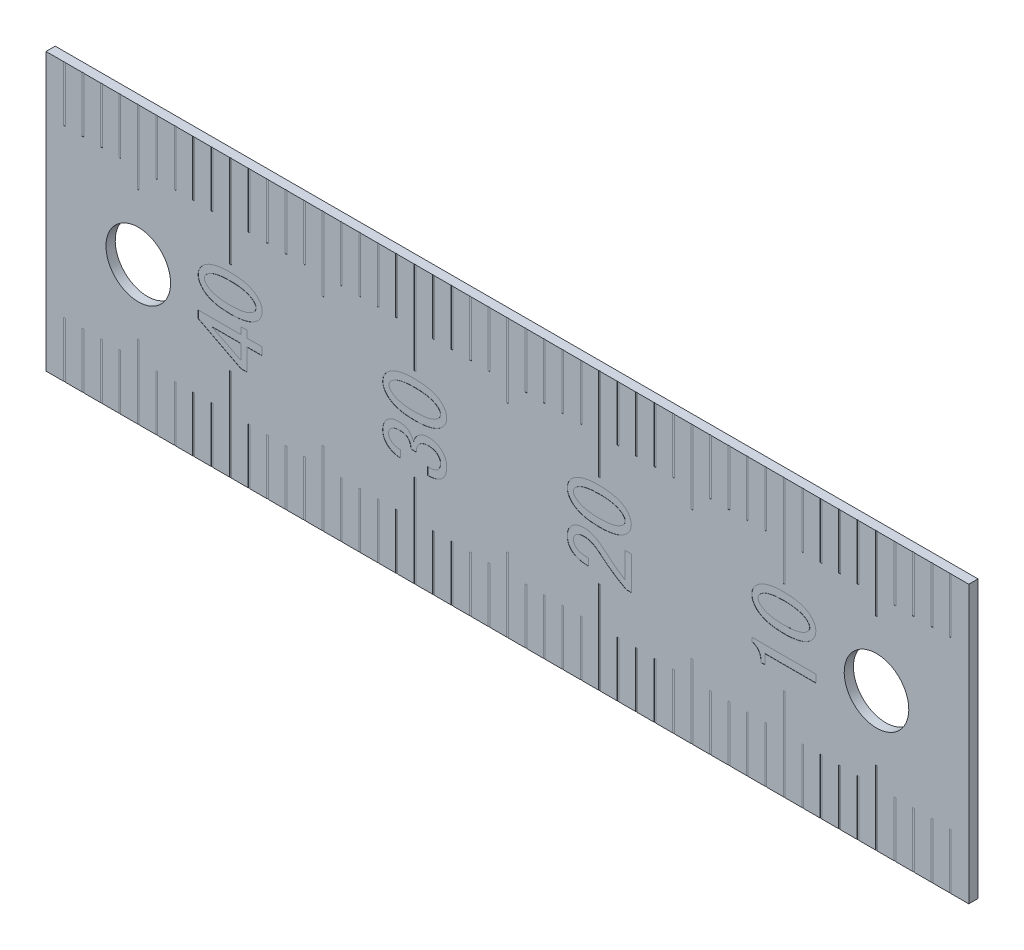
SolidWorks part; units mm, degrees
ref_plane "Front" through (0, 0, 0) normal (0, 0, 1) x (1, 0, 0)
ref_plane "Top" through (0, 0, 0) normal (0, 1, 0) x (1, 0, 0)
ref_plane "Right" through (0, 0, 0) normal (1, 0, 0) x (0, 0, -1)
sketch "Sketch1" plane through (0, 0, 0) normal (0, 0, 1) x (1, 0, 0)
  line L1 (0, 0) -> (0, 50)
  line L2 (0, 0) -> (15, 0)
  line L3 (15, 0) -> (15, 50)
  line L4 (0, 50) -> (15, 50)
  dimension "D1" = 50
  dimension "D2" = 15
extrude "Extrude1" add sketch "Sketch1" along normal blind 0.5
sketch "Sketch2" plane through (0, 0, 0.5) normal (0, 0, 1) x (1, 0, 0)
  line L0 (0, 50) -> (0, 0) construction
  line L1 (0, 0) -> (15, 0) construction
  line L2 (15, 50) -> (0, 50) construction
  circle A0 centre (7.5, 5) radius 1.75
  circle A1 centre (7.5, 45) radius 1.75
  dimension "D1" = 7.5
  dimension "D2" = 7.5
  dimension "D3" = 5
  dimension "D4" = 5
  dimension "D5" = 3.5
  dimension "D6" = 3.5
extrude "Extrude2" cut sketch "Sketch2" against normal through all
sketch "Sketch3" plane through (0, 0, 0.5) normal (0, 0, 1) x (1, 0, 0)
  line L0 (15, 50) -> (0, 50) construction
  line L1 (5.25, 28.25) -> (9.75, 28.25) construction
  line L2 (5.25, 18.25) -> (9.75, 18.25) construction
  line L3 (5.25, 8.25) -> (9.75, 8.25) construction
  line L5 (0, 50) -> (0, 0) construction
  line L7 (5.25, 38.25) -> (9.75, 38.25) construction
  line L8 (5.25, 38.25) -> (5.25, 41.75) construction
  line L9 (7.5, 0) -> (7.5, 50) construction
  line L10 (0, 0) -> (15, 0) construction
  line L11 (0, 40) -> (15, 40) construction
  line L12 (15, 0) -> (15, 50) construction
  line L13 (5.25, 41.75) -> (9.75, 41.75) construction
  line L14 (9.75, 38.25) -> (9.75, 41.75) construction
  line L15 (5.25, 38.25) -> (9.75, 41.75) construction
  line L16 (5.25, 41.75) -> (9.75, 38.25) construction
  circle A0 centre (7.5, 45) radius 1.75 construction
  text T0 "40" font "ＭＳ ゴシック" height 3.5
  text T1 "30" font "ＭＳ ゴシック" height 3.5
  text T2 "20" font "ＭＳ ゴシック" height 3.5
  text T3 "10" font "ＭＳ ゴシック" height 3.5
  point P7 (7.5, 40)
  dimension "D2" = 7.5
  dimension "D1" = 4
  dimension "D6" = 10
  dimension "D5" = 4.5
  dimension "D7" = 3.5
extrude "Extrude3" cut sketch "Sketch3" against normal blind 0.01
sketch "Sketch4" plane through (0, 0, 0.5) normal (0, 0, 1) x (1, 0, 0)
  line L0 (15, 40.05) -> (10, 40.05)
  line L1 (15, 0) -> (15, 50) construction
  line L2 (10, 40.05) -> (10, 39.95)
  line L3 (10, 39.95) -> (15, 39.95)
  line L4 (15, 39.95) -> (15, 40.05)
  line L5 (15, 50) -> (0, 50) construction
  line L6 (15, 48.05) -> (15, 47.95)
  line L7 (15, 44.95) -> (11, 44.95)
  line L8 (15, 44.95) -> (15, 45.05)
  line L9 (15, 45.05) -> (11, 45.05)
  line L10 (11, 44.95) -> (11, 45.05)
  line L11 (15, 49.05) -> (12, 49.05)
  line L12 (15, 49.05) -> (15, 48.95)
  line L13 (15, 48.95) -> (12, 48.95)
  line L14 (12, 49.05) -> (12, 48.95)
  line L15 (15, 48.05) -> (12, 48.05)
  line L16 (15, 47.95) -> (12, 47.95)
  line L17 (12, 48.05) -> (12, 47.95)
  line L18 (15, 47.05) -> (15, 46.95)
  line L19 (15, 47.05) -> (12, 47.05)
  line L20 (15, 46.95) -> (12, 46.95)
  line L21 (12, 47.05) -> (12, 46.95)
  line L22 (15, 46.05) -> (15, 45.95)
  line L23 (15, 46.05) -> (12, 46.05)
  line L24 (15, 45.95) -> (12, 45.95)
  line L25 (12, 46.05) -> (12, 45.95)
  line L26 (15, 30.05) -> (10, 30.05)
  line L27 (10, 30.05) -> (10, 29.95)
  line L28 (10, 29.95) -> (15, 29.95)
  line L29 (15, 29.95) -> (15, 30.05)
  line L30 (15, 44.05) -> (15, 43.95)
  line L31 (15, 44.05) -> (12, 44.05)
  line L32 (15, 43.95) -> (12, 43.95)
  line L33 (12, 44.05) -> (12, 43.95)
  line L34 (15, 43.05) -> (15, 42.95)
  line L35 (15, 43.05) -> (12, 43.05)
  line L36 (15, 42.95) -> (12, 42.95)
  line L37 (12, 43.05) -> (12, 42.95)
  line L38 (15, 42.05) -> (15, 41.95)
  line L39 (15, 42.05) -> (12, 42.05)
  line L40 (15, 41.95) -> (12, 41.95)
  line L41 (12, 42.05) -> (12, 41.95)
  line L42 (15, 41.05) -> (15, 40.95)
  line L43 (15, 41.05) -> (12, 41.05)
  line L44 (15, 40.95) -> (12, 40.95)
  line L45 (12, 41.05) -> (12, 40.95)
  line L46 (12, 45.05) -> (12, 44.95)
  line L47 (15, 45.05) -> (12, 45.05)
  line L48 (15, 44.95) -> (12, 44.95)
  line L49 (15, 45.05) -> (15, 44.95)
  line L50 (15, 38.05) -> (15, 37.95)
  line L51 (15, 34.95) -> (11, 34.95)
  line L52 (15, 34.95) -> (15, 35.05)
  line L53 (15, 35.05) -> (11, 35.05)
  line L54 (11, 34.95) -> (11, 35.05)
  line L55 (15, 39.05) -> (12, 39.05)
  line L56 (15, 39.05) -> (15, 38.95)
  line L57 (15, 38.95) -> (12, 38.95)
  line L58 (12, 39.05) -> (12, 38.95)
  line L59 (15, 38.05) -> (12, 38.05)
  line L60 (15, 37.95) -> (12, 37.95)
  line L61 (12, 38.05) -> (12, 37.95)
  line L62 (15, 37.05) -> (15, 36.95)
  line L63 (15, 37.05) -> (12, 37.05)
  line L64 (15, 36.95) -> (12, 36.95)
  line L65 (12, 37.05) -> (12, 36.95)
  line L66 (15, 36.05) -> (15, 35.95)
  line L67 (15, 36.05) -> (12, 36.05)
  line L68 (15, 35.95) -> (12, 35.95)
  line L69 (12, 36.05) -> (12, 35.95)
  line L70 (15, 34.05) -> (15, 33.95)
  line L71 (15, 34.05) -> (12, 34.05)
  line L72 (15, 33.95) -> (12, 33.95)
  line L73 (12, 34.05) -> (12, 33.95)
  line L74 (15, 33.05) -> (15, 32.95)
  line L75 (15, 33.05) -> (12, 33.05)
  line L76 (15, 32.95) -> (12, 32.95)
  line L77 (12, 33.05) -> (12, 32.95)
  line L78 (15, 32.05) -> (15, 31.95)
  line L79 (15, 32.05) -> (12, 32.05)
  line L80 (15, 31.95) -> (12, 31.95)
  line L81 (12, 32.05) -> (12, 31.95)
  line L82 (15, 31.05) -> (15, 30.95)
  line L83 (15, 31.05) -> (12, 31.05)
  line L84 (15, 30.95) -> (12, 30.95)
  line L85 (12, 31.05) -> (12, 30.95)
  line L86 (15, 20.05) -> (10, 20.05)
  line L87 (10, 20.05) -> (10, 19.95)
  line L88 (10, 19.95) -> (15, 19.95)
  line L89 (15, 19.95) -> (15, 20.05)
  line L90 (15, 28.05) -> (15, 27.95)
  line L91 (15, 24.95) -> (11, 24.95)
  line L92 (15, 24.95) -> (15, 25.05)
  line L93 (15, 25.05) -> (11, 25.05)
  line L94 (11, 24.95) -> (11, 25.05)
  line L95 (15, 29.05) -> (12, 29.05)
  line L96 (15, 29.05) -> (15, 28.95)
  line L97 (15, 28.95) -> (12, 28.95)
  line L98 (12, 29.05) -> (12, 28.95)
  line L99 (15, 28.05) -> (12, 28.05)
  line L100 (15, 27.95) -> (12, 27.95)
  line L101 (12, 28.05) -> (12, 27.95)
  line L102 (15, 27.05) -> (15, 26.95)
  line L103 (15, 27.05) -> (12, 27.05)
  line L104 (15, 26.95) -> (12, 26.95)
  line L105 (12, 27.05) -> (12, 26.95)
  line L106 (15, 26.05) -> (15, 25.95)
  line L107 (15, 26.05) -> (12, 26.05)
  line L108 (15, 25.95) -> (12, 25.95)
  line L109 (12, 26.05) -> (12, 25.95)
  line L110 (15, 24.05) -> (15, 23.95)
  line L111 (15, 24.05) -> (12, 24.05)
  line L112 (15, 23.95) -> (12, 23.95)
  line L113 (12, 24.05) -> (12, 23.95)
  line L114 (15, 23.05) -> (15, 22.95)
  line L115 (15, 23.05) -> (12, 23.05)
  line L116 (15, 22.95) -> (12, 22.95)
  line L117 (12, 23.05) -> (12, 22.95)
  line L118 (15, 22.05) -> (15, 21.95)
  line L119 (15, 22.05) -> (12, 22.05)
  line L120 (15, 21.95) -> (12, 21.95)
  line L121 (12, 22.05) -> (12, 21.95)
  line L122 (15, 21.05) -> (15, 20.95)
  line L123 (15, 21.05) -> (12, 21.05)
  line L124 (15, 20.95) -> (12, 20.95)
  line L125 (12, 21.05) -> (12, 20.95)
  line L126 (15, 10.05) -> (10, 10.05)
  line L127 (10, 10.05) -> (10, 9.95)
  line L128 (10, 9.95) -> (15, 9.95)
  line L129 (15, 9.95) -> (15, 10.05)
  line L130 (15, 18.05) -> (15, 17.95)
  line L131 (15, 14.95) -> (11, 14.95)
  line L132 (15, 14.95) -> (15, 15.05)
  line L133 (15, 15.05) -> (11, 15.05)
  line L134 (11, 14.95) -> (11, 15.05)
  line L135 (15, 19.05) -> (12, 19.05)
  line L136 (15, 19.05) -> (15, 18.95)
  line L137 (15, 18.95) -> (12, 18.95)
  line L138 (12, 19.05) -> (12, 18.95)
  line L139 (15, 18.05) -> (12, 18.05)
  line L140 (15, 17.95) -> (12, 17.95)
  line L141 (12, 18.05) -> (12, 17.95)
  line L142 (15, 17.05) -> (15, 16.95)
  line L143 (15, 17.05) -> (12, 17.05)
  line L144 (15, 16.95) -> (12, 16.95)
  line L145 (12, 17.05) -> (12, 16.95)
  line L146 (15, 16.05) -> (15, 15.95)
  line L147 (15, 16.05) -> (12, 16.05)
  line L148 (15, 15.95) -> (12, 15.95)
  line L149 (12, 16.05) -> (12, 15.95)
  line L150 (15, 14.05) -> (15, 13.95)
  line L151 (15, 14.05) -> (12, 14.05)
  line L152 (15, 13.95) -> (12, 13.95)
  line L153 (12, 14.05) -> (12, 13.95)
  line L154 (15, 13.05) -> (15, 12.95)
  line L155 (15, 13.05) -> (12, 13.05)
  line L156 (15, 12.95) -> (12, 12.95)
  line L157 (12, 13.05) -> (12, 12.95)
  line L158 (15, 12.05) -> (15, 11.95)
  line L159 (15, 12.05) -> (12, 12.05)
  line L160 (15, 11.95) -> (12, 11.95)
  line L161 (12, 12.05) -> (12, 11.95)
  line L162 (15, 11.05) -> (15, 10.95)
  line L163 (15, 11.05) -> (12, 11.05)
  line L164 (15, 10.95) -> (12, 10.95)
  line L165 (12, 11.05) -> (12, 10.95)
  line L166 (7.5, 50) -> (7.5, 36.693) construction
  line L167 (3, 1.05) -> (3, 0.95)
  line L168 (0, 0.95) -> (3, 0.95)
  line L169 (0, 1.05) -> (3, 1.05)
  line L170 (15, 8.05) -> (15, 7.95)
  line L171 (15, 4.95) -> (11, 4.95)
  line L172 (15, 4.95) -> (15, 5.05)
  line L173 (15, 5.05) -> (11, 5.05)
  line L174 (11, 4.95) -> (11, 5.05)
  line L175 (15, 9.05) -> (12, 9.05)
  line L176 (15, 9.05) -> (15, 8.95)
  line L177 (15, 8.95) -> (12, 8.95)
  line L178 (12, 9.05) -> (12, 8.95)
  line L179 (15, 8.05) -> (12, 8.05)
  line L180 (15, 7.95) -> (12, 7.95)
  line L181 (12, 8.05) -> (12, 7.95)
  line L182 (15, 7.05) -> (15, 6.95)
  line L183 (15, 7.05) -> (12, 7.05)
  line L184 (15, 6.95) -> (12, 6.95)
  line L185 (12, 7.05) -> (12, 6.95)
  line L186 (15, 6.05) -> (15, 5.95)
  line L187 (15, 6.05) -> (12, 6.05)
  line L188 (15, 5.95) -> (12, 5.95)
  line L189 (12, 6.05) -> (12, 5.95)
  line L190 (15, 4.05) -> (15, 3.95)
  line L191 (15, 4.05) -> (12, 4.05)
  line L192 (15, 3.95) -> (12, 3.95)
  line L193 (12, 4.05) -> (12, 3.95)
  line L194 (15, 3.05) -> (15, 2.95)
  line L195 (15, 3.05) -> (12, 3.05)
  line L196 (15, 2.95) -> (12, 2.95)
  line L197 (12, 3.05) -> (12, 2.95)
  line L198 (15, 2.05) -> (15, 1.95)
  line L199 (15, 2.05) -> (12, 2.05)
  line L200 (15, 1.95) -> (12, 1.95)
  line L201 (12, 2.05) -> (12, 1.95)
  line L202 (15, 1.05) -> (15, 0.95)
  line L203 (15, 1.05) -> (12, 1.05)
  line L204 (15, 0.95) -> (12, 0.95)
  line L205 (12, 1.05) -> (12, 0.95)
  line L206 (15, 0.05) -> (10, 0.05)
  line L207 (10, 0.05) -> (10, -0.05)
  line L208 (10, -0.05) -> (15, -0.05)
  line L209 (15, -0.05) -> (15, 0.05)
  line L210 (0, 1.05) -> (0, 0.95)
  line L211 (3, 2.05) -> (3, 1.95)
  line L212 (0, 1.95) -> (3, 1.95)
  line L213 (0, 2.05) -> (3, 2.05)
  line L214 (0, 2.05) -> (0, 1.95)
  line L215 (3, 3.05) -> (3, 2.95)
  line L216 (0, 2.95) -> (3, 2.95)
  line L217 (0, 3.05) -> (3, 3.05)
  line L218 (0, 3.05) -> (0, 2.95)
  line L219 (3, 4.05) -> (3, 3.95)
  line L220 (0, 3.95) -> (3, 3.95)
  line L221 (0, 4.05) -> (3, 4.05)
  line L222 (0, 4.05) -> (0, 3.95)
  line L223 (3, 6.05) -> (3, 5.95)
  line L224 (0, 5.95) -> (3, 5.95)
  line L225 (0, 6.05) -> (3, 6.05)
  line L226 (0, 6.05) -> (0, 5.95)
  line L227 (3, 7.05) -> (3, 6.95)
  line L228 (0, 6.95) -> (3, 6.95)
  line L229 (0, 7.05) -> (3, 7.05)
  line L230 (0, 7.05) -> (0, 6.95)
  line L231 (3, 8.05) -> (3, 7.95)
  line L232 (0, 7.95) -> (3, 7.95)
  line L233 (0, 8.05) -> (3, 8.05)
  line L234 (3, 9.05) -> (3, 8.95)
  line L235 (0, 8.95) -> (3, 8.95)
  line L236 (0, 9.05) -> (0, 8.95)
  line L237 (0, 9.05) -> (3, 9.05)
  line L238 (4, 4.95) -> (4, 5.05)
  line L239 (0, 5.05) -> (4, 5.05)
  line L240 (0, 4.95) -> (0, 5.05)
  line L241 (0, 4.95) -> (4, 4.95)
  line L242 (0, 8.05) -> (0, 7.95)
  line L243 (3, 11.05) -> (3, 10.95)
  line L244 (0, 10.95) -> (3, 10.95)
  line L245 (0, 11.05) -> (3, 11.05)
  line L246 (0, 11.05) -> (0, 10.95)
  line L247 (3, 12.05) -> (3, 11.95)
  line L248 (0, 11.95) -> (3, 11.95)
  line L249 (0, 12.05) -> (3, 12.05)
  line L250 (0, 12.05) -> (0, 11.95)
  line L251 (3, 13.05) -> (3, 12.95)
  line L252 (0, 12.95) -> (3, 12.95)
  line L253 (0, 13.05) -> (3, 13.05)
  line L254 (0, 13.05) -> (0, 12.95)
  line L255 (3, 14.05) -> (3, 13.95)
  line L256 (0, 13.95) -> (3, 13.95)
  line L257 (0, 14.05) -> (3, 14.05)
  line L258 (0, 14.05) -> (0, 13.95)
  line L259 (3, 16.05) -> (3, 15.95)
  line L260 (0, 15.95) -> (3, 15.95)
  line L261 (0, 16.05) -> (3, 16.05)
  line L262 (0, 16.05) -> (0, 15.95)
  line L263 (3, 17.05) -> (3, 16.95)
  line L264 (0, 16.95) -> (3, 16.95)
  line L265 (0, 17.05) -> (3, 17.05)
  line L266 (0, 17.05) -> (0, 16.95)
  line L267 (3, 18.05) -> (3, 17.95)
  line L268 (0, 17.95) -> (3, 17.95)
  line L269 (0, 18.05) -> (3, 18.05)
  line L270 (3, 19.05) -> (3, 18.95)
  line L271 (0, 18.95) -> (3, 18.95)
  line L272 (0, 19.05) -> (0, 18.95)
  line L273 (0, 19.05) -> (3, 19.05)
  line L274 (4, 14.95) -> (4, 15.05)
  line L275 (0, 15.05) -> (4, 15.05)
  line L276 (0, 14.95) -> (0, 15.05)
  line L277 (0, 14.95) -> (4, 14.95)
  line L278 (0, 18.05) -> (0, 17.95)
  line L279 (0, 9.95) -> (0, 10.05)
  line L280 (5, 9.95) -> (0, 9.95)
  line L281 (5, 10.05) -> (5, 9.95)
  line L282 (0, 10.05) -> (5, 10.05)
  line L283 (3, 21.05) -> (3, 20.95)
  line L284 (0, 20.95) -> (3, 20.95)
  line L285 (0, 21.05) -> (3, 21.05)
  line L286 (0, 21.05) -> (0, 20.95)
  line L287 (3, 22.05) -> (3, 21.95)
  line L288 (0, 21.95) -> (3, 21.95)
  line L289 (0, 22.05) -> (3, 22.05)
  line L290 (0, 22.05) -> (0, 21.95)
  line L291 (3, 23.05) -> (3, 22.95)
  line L292 (0, 22.95) -> (3, 22.95)
  line L293 (0, 23.05) -> (3, 23.05)
  line L294 (0, 23.05) -> (0, 22.95)
  line L295 (3, 24.05) -> (3, 23.95)
  line L296 (0, 23.95) -> (3, 23.95)
  line L297 (0, 24.05) -> (3, 24.05)
  line L298 (0, 24.05) -> (0, 23.95)
  line L299 (3, 26.05) -> (3, 25.95)
  line L300 (0, 25.95) -> (3, 25.95)
  line L301 (0, 26.05) -> (3, 26.05)
  line L302 (0, 26.05) -> (0, 25.95)
  line L303 (3, 27.05) -> (3, 26.95)
  line L304 (0, 26.95) -> (3, 26.95)
  line L305 (0, 27.05) -> (3, 27.05)
  line L306 (0, 27.05) -> (0, 26.95)
  line L307 (3, 28.05) -> (3, 27.95)
  line L308 (0, 27.95) -> (3, 27.95)
  line L309 (0, 28.05) -> (3, 28.05)
  line L310 (3, 29.05) -> (3, 28.95)
  line L311 (0, 28.95) -> (3, 28.95)
  line L312 (0, 29.05) -> (0, 28.95)
  line L313 (0, 29.05) -> (3, 29.05)
  line L314 (4, 24.95) -> (4, 25.05)
  line L315 (0, 25.05) -> (4, 25.05)
  line L316 (0, 24.95) -> (0, 25.05)
  line L317 (0, 24.95) -> (4, 24.95)
  line L318 (0, 28.05) -> (0, 27.95)
  line L319 (0, 19.95) -> (0, 20.05)
  line L320 (5, 19.95) -> (0, 19.95)
  line L321 (5, 20.05) -> (5, 19.95)
  line L322 (0, 20.05) -> (5, 20.05)
  line L323 (3, 31.05) -> (3, 30.95)
  line L324 (0, 30.95) -> (3, 30.95)
  line L325 (0, 31.05) -> (3, 31.05)
  line L326 (0, 31.05) -> (0, 30.95)
  line L327 (3, 32.05) -> (3, 31.95)
  line L328 (0, 31.95) -> (3, 31.95)
  line L329 (0, 32.05) -> (3, 32.05)
  line L330 (0, 32.05) -> (0, 31.95)
  line L331 (3, 33.05) -> (3, 32.95)
  line L332 (0, 32.95) -> (3, 32.95)
  line L333 (0, 33.05) -> (3, 33.05)
  line L334 (0, 33.05) -> (0, 32.95)
  line L335 (3, 34.05) -> (3, 33.95)
  line L336 (0, 33.95) -> (3, 33.95)
  line L337 (0, 34.05) -> (3, 34.05)
  line L338 (0, 34.05) -> (0, 33.95)
  line L339 (3, 36.05) -> (3, 35.95)
  line L340 (0, 35.95) -> (3, 35.95)
  line L341 (0, 36.05) -> (3, 36.05)
  line L342 (0, 36.05) -> (0, 35.95)
  line L343 (3, 37.05) -> (3, 36.95)
  line L344 (0, 36.95) -> (3, 36.95)
  line L345 (0, 37.05) -> (3, 37.05)
  line L346 (0, 37.05) -> (0, 36.95)
  line L347 (3, 38.05) -> (3, 37.95)
  line L348 (0, 37.95) -> (3, 37.95)
  line L349 (0, 38.05) -> (3, 38.05)
  line L350 (3, 39.05) -> (3, 38.95)
  line L351 (0, 38.95) -> (3, 38.95)
  line L352 (0, 39.05) -> (0, 38.95)
  line L353 (0, 39.05) -> (3, 39.05)
  line L354 (4, 34.95) -> (4, 35.05)
  line L355 (0, 35.05) -> (4, 35.05)
  line L356 (0, 34.95) -> (0, 35.05)
  line L357 (0, 34.95) -> (4, 34.95)
  line L358 (0, 38.05) -> (0, 37.95)
  line L359 (3, 41.05) -> (3, 40.95)
  line L360 (0, 40.95) -> (3, 40.95)
  line L361 (0, 41.05) -> (3, 41.05)
  line L362 (0, 41.05) -> (0, 40.95)
  line L363 (3, 42.05) -> (3, 41.95)
  line L364 (0, 41.95) -> (3, 41.95)
  line L365 (0, 42.05) -> (3, 42.05)
  line L366 (0, 42.05) -> (0, 41.95)
  line L367 (3, 43.05) -> (3, 42.95)
  line L368 (0, 42.95) -> (3, 42.95)
  line L369 (0, 43.05) -> (3, 43.05)
  line L370 (0, 43.05) -> (0, 42.95)
  line L371 (3, 44.05) -> (3, 43.95)
  line L372 (0, 43.95) -> (3, 43.95)
  line L373 (0, 44.05) -> (3, 44.05)
  line L374 (0, 44.05) -> (0, 43.95)
  line L375 (0, 29.95) -> (0, 30.05)
  line L376 (5, 29.95) -> (0, 29.95)
  line L377 (5, 30.05) -> (5, 29.95)
  line L378 (0, 30.05) -> (5, 30.05)
  line L379 (3, 46.05) -> (3, 45.95)
  line L380 (0, 45.95) -> (3, 45.95)
  line L381 (0, 46.05) -> (3, 46.05)
  line L382 (0, 46.05) -> (0, 45.95)
  line L383 (3, 47.05) -> (3, 46.95)
  line L384 (0, 46.95) -> (3, 46.95)
  line L385 (0, 47.05) -> (3, 47.05)
  line L386 (0, 47.05) -> (0, 46.95)
  line L387 (3, 48.05) -> (3, 47.95)
  line L388 (0, 47.95) -> (3, 47.95)
  line L389 (0, 48.05) -> (3, 48.05)
  line L390 (3, 49.05) -> (3, 48.95)
  line L391 (0, 48.95) -> (3, 48.95)
  line L392 (0, 49.05) -> (0, 48.95)
  line L393 (0, 49.05) -> (3, 49.05)
  line L394 (4, 44.95) -> (4, 45.05)
  line L395 (0, 45.05) -> (4, 45.05)
  line L396 (0, 44.95) -> (0, 45.05)
  line L397 (0, 44.95) -> (4, 44.95)
  line L398 (0, 48.05) -> (0, 47.95)
  line L399 (0, 39.95) -> (0, 40.05)
  line L400 (5, 39.95) -> (0, 39.95)
  line L401 (5, 40.05) -> (5, 39.95)
  line L402 (0, 40.05) -> (5, 40.05)
  point P4 (15, 40)
  point P13 (15, 45)
  point P18 (15, 49)
  dimension "D1" = 10
  dimension "D2" = 0.1
  dimension "D3" = 5
  dimension "D4" = 5
  dimension "D5" = 0.1
  dimension "D6" = 1
  dimension "D7" = 0.1
  dimension "D8" = 3
  dimension "D9" = 4
  dimension "D10" = 9
  dimension "D11" = 5
extrude "Extrude4" cut sketch "Sketch4" against normal blind 0.01
move or copy body "Body-Move/Copy2" bodies to move or copy 105 copy no rotation origin (0, 0, 0) rotation axis (0, 0, 1) rotation angle 90
move or copy body "Body-Move/Copy3" bodies to move or copy 107 copy no translate (0, -7.5, 0)
